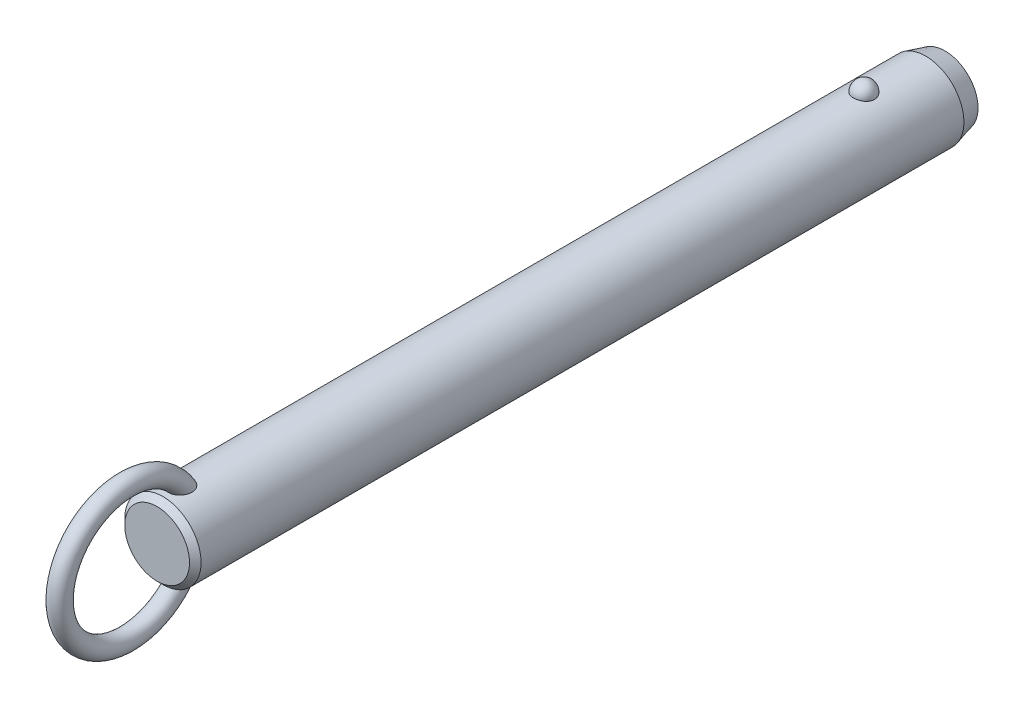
SolidWorks part; units mm, degrees
ref_plane "Front Plane" through (0, 0, 0) normal (0, 0, 1) x (1, 0, 0)
ref_plane "Top Plane" through (0, 0, 0) normal (0, 1, 0) x (1, 0, 0)
ref_plane "Right Plane" through (0, 0, 0) normal (1, 0, 0) x (0, 0, -1)
sketch "Sketch2" plane through (0, 0, 0) normal (0, 0, 1) x (1, 0, 0)
  circle A0 centre (0, 0) radius 7.9
  point P3 (0, 7.9)
  dimension "D1" = 15.8
extrude "Boss-Extrude1" add sketch "Sketch2" along normal blind 134.6
sketch "Sketch3" plane through (0, 0, 0) normal (0, 0, -1) x (-1, 0, 0)
  circle A0 centre (0, 0) radius 7.9
  dimension "D1" = 15.8
extrude "Boss-Extrude2" add sketch "Sketch3" along normal blind 19
chamfer "Chamfer1" distance 4 angle 15 1 edges at (-7.9, 0, -19)
sketch "Sketch12" plane through (0, 0, 0) normal (1, 0, 0) x (0, 0, -1)
  line L0 (-134.6, 7.9) -> (-134.6, -7.9) construction
  point P0 (-134.6, 0)
sketch "Sketch13" plane through (0, 0, 0) normal (1, 0, 0) x (0, 0, -1)
  circle A0 centre (-150.45, 0) radius 15.85
  point P2 (-134.6, 0)
  dimension "D1" = 31.7
sketch "Sketch14" plane through (0, 0, 0) normal (0, 1, 0) x (1, 0, 0)
  circle A0 centre (0, -136.6) radius 2
  point P2 (0, -134.6)
  dimension "D1" = 4
sweep "Sweep1" add profiles "Sketch14" path "Sketch13"
sketch "Sketch15" plane through (0, 0, 134.6) normal (0, 0, 1) x (1, 0, 0)
  circle A0 centre (0, 0) radius 7.9
  dimension "D1" = 15.8
extrude "Boss-Extrude3" add sketch "Sketch15" along normal blind 9.52
chamfer "Chamfer2" distance 1.2 angle 45 1 edges at (7.9, 0, 144.12)
sketch "Sketch18" plane through (0, 0, 0) normal (1, 0, 0) x (0, 0, -1)
  line L0 (15, 7.9) -> (-136.7091, 7.9) construction
  line L1 (2.2, 10.1) -> (2.2, 5.7)
  line L2 (-136.7091, -7.9) -> (15, -7.9) construction
  arc A0 (2.2, 10.1) -> (2.2, 5.7) centre (2.2, 7.9) ccw
  point P4 (0, 7.9)
  dimension "D1" = 18
revolve "Revolve1" add sketch "Sketch18" angle 360 about L1
